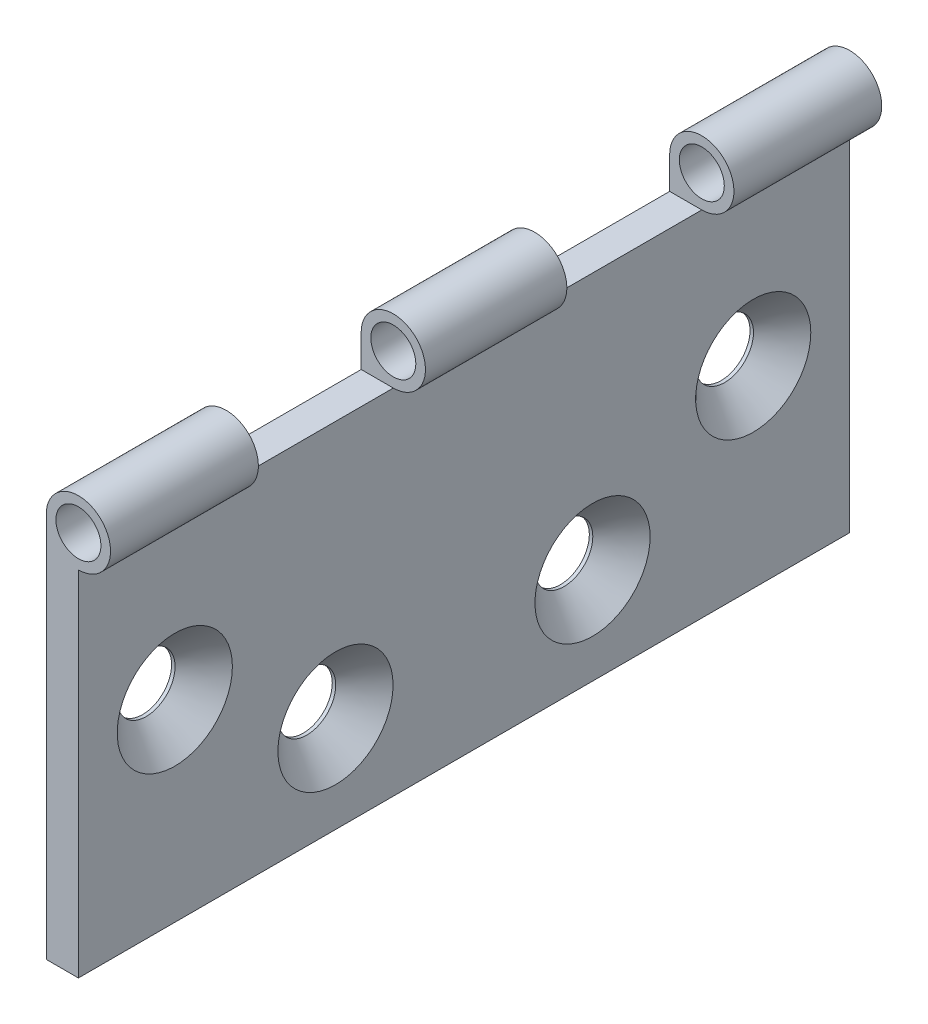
SolidWorks part; units mm, degrees
ref_plane "Alzado" through (0, 0, 0) normal (0, 0, 1) x (1, 0, 0)
ref_plane "Planta" through (0, 0, 0) normal (0, 1, 0) x (1, 0, 0)
ref_plane "Vista lateral" through (0, 0, 0) normal (1, 0, 0) x (0, 0, -1)
sketch "Croquis1" plane through (0, 0, 0) normal (0, 0, 1) x (1, 0, 0)
  line L0 (0, 0) -> (0, 60)
extrude "Extruir-Lámina1" add sketch "Croquis1" along normal mid plane 120 thin
sketch "Croquis2" plane through (0, 0, 60) normal (0, 0, 1) x (1, 0, 0)
  circle A0 centre (5, 60) radius 5
sweep "Barrer1" add profiles "Croquis2"
sketch "Croquis3" plane through (0, 0, 60) normal (0, 0, 1) x (1, 0, 0)
  circle A0 centre (5, 60) radius 3.5
  dimension "D1" = 7
extrude "Cortar-Extruir1" cut sketch "Croquis3" against normal through all
hole_wizard "Refrentado para tornillo tapón con cabeza plana de clavija de M82" positions "Croquis7" profile "Croquis6" countersink size "M8" standard "Ansi Metric"
sketch "Croquis7" plane through (5, 0, 0) normal (1, 0, 0) x (0, 0, -1)
  line L0 (-60, 0) -> (60, 0) construction
  line L1 (-60, 0) -> (-60, 55) construction
  point P0 (-45, 30)
  point P2 (-20, 15)
sketch "Croquis6" plane through (5, 30, 45) normal (0, 1, 0) x (0, 0, -1)
  line L0 (0, 0) -> (0, 5)
  line L1 (0, 5) -> (4.5, 5)
  line L2 (4.5, 5) -> (4.5, 4.46)
  line L3 (4.5, 4.46) -> (8.96, 0)
  line L5 (8.96, 0) -> (0, 0)
  line L6 (-4.5, 4.46) -> (-8.96, 0) construction
  line L11 (0, -6.35) -> (0, 107.95) construction
  dimension "Diámetro de taladro hasta el siguiente" = 9
  dimension "Profundidad de taladro hasta el siguiente" = 5
  dimension "Diámetro de avellanado cercano" = 17.92
  dimension "Ángulo de avellanado cercano" = 90
mirror "Simetría1" about plane through (0, 0, 0) normal (0, 0, 1) of "Refrentado para tornillo tapón con cabeza plana de clavija de M82"
sketch "diseño de cortes" plane through (5, 0, 0) normal (1, 0, 0) x (0, 0, -1)
  line L1 (-60, 65) -> (-60, 55) construction
  line L2 (60, 54) -> (-60, 54)
  line L3 (60, 54) -> (-60, 54)
  line L4 (60, 55) -> (60, 65) construction
  line L5 (-60, 65) -> (-60, 54)
  line L6 (60, 54) -> (60, 65)
  line L7 (-60, 65) -> (60, 65)
  line L8 (-36, 65) -> (-36, 54)
  line L9 (-12, 65) -> (-12, 54)
  line L11 (0, 65) -> (0, 0) construction
  line L12 (12, 65) -> (12, 54)
  line L13 (36, 65) -> (36, 54)
sketch "Croquis11" plane through (5, 0, 0) normal (1, 0, 0) x (0, 0, -1)
  line L0 (60, 54) -> (-60, 54) construction
  line L1 (-60, 65) -> (-60, 54) construction
  line L2 (-60, 65) -> (60, 65) construction
  line L3 (60, 54) -> (60, 65) construction
  line L4 (60, 0) -> (60, 55)
  line L5 (60, 55) -> (-60, 55)
  line L6 (-60, 55) -> (-60, 0)
  line L7 (-60, 0) -> (60, 0)
  line L8 (60, 0) -> (60, 55)
  line L9 (60, 55) -> (-60, 55)
  line L10 (-60, 55) -> (-60, 0)
  line L11 (-60, 0) -> (60, 0)
  line L12 (37, 54) -> (11, 54)
  line L13 (-60, 55) -> (-60, 54)
  line L14 (-37, 65) -> (-11, 65)
  line L15 (60, 54) -> (60, 55)
  line L18 (-37, 65) -> (-37, 54)
  line L19 (-37, 65) -> (-37, 54)
  line L21 (37, 65) -> (37, 54)
  line L22 (37, 65) -> (37, 54)
  line L24 (-11, 65) -> (-11, 54)
  line L25 (-11, 65) -> (-11, 54)
  line L26 (11, 65) -> (37, 65)
  line L27 (11, 65) -> (11, 54)
  line L28 (11, 65) -> (11, 54)
  line L29 (-11, 54) -> (-37, 54)
  dimension "D1" = 0
  dimension "D2" = 1
  dimension "D3" = 1
  dimension "D4" = 1
  dimension "D5" = 1
extrude "2Cortes" cut sketch "Croquis11" against normal through all and the other way through all contours L25 L14 L19 M14 | L26 L28 L9 L22
sketch "Croquis10" plane through (5, 0, 0) normal (1, 0, 0) x (0, 0, -1)
  line L0 (60, 54) -> (-60, 54) construction
  line L1 (-60, 65) -> (-60, 54) construction
  line L2 (-60, 65) -> (60, 65) construction
  line L3 (60, 54) -> (60, 65) construction
  line L4 (60, 0) -> (60, 55)
  line L5 (60, 55) -> (37, 55)
  line L6 (-60, 55) -> (-60, 0)
  line L7 (-60, 0) -> (60, 0)
  line L8 (60, 0) -> (60, 55)
  line L9 (60, 55) -> (37, 55)
  line L10 (-60, 55) -> (-60, 0)
  line L11 (-60, 0) -> (60, 0)
  line L12 (60, 54) -> (35, 54)
  line L13 (-60, 65) -> (-60, 54)
  line L14 (-60, 65) -> (-35, 65)
  line L15 (60, 54) -> (60, 65)
  line L18 (-35, 65) -> (-35, 54)
  line L19 (-35, 65) -> (-35, 54)
  line L21 (35, 65) -> (35, 54)
  line L22 (35, 65) -> (35, 54)
  line L24 (-13, 65) -> (-13, 54)
  line L25 (-13, 65) -> (-13, 54)
  line L26 (-13, 65) -> (13, 65)
  line L27 (13, 65) -> (13, 54)
  line L28 (13, 65) -> (13, 54)
  line L29 (-35, 54) -> (-60, 54)
  line L30 (35, 65) -> (60, 65)
  line L31 (13, 54) -> (-13, 54)
  line L36 (37, 55) -> (11, 55)
  line L37 (37, 55) -> (11, 55)
  line L38 (11, 55) -> (-11, 55)
  line L39 (11, 55) -> (-11, 55)
  line L40 (-11, 55) -> (-37, 55)
  line L41 (-11, 55) -> (-37, 55)
  line L42 (-37, 55) -> (-60, 55)
  line L43 (-37, 55) -> (-60, 55)
  dimension "D1" = 0
  dimension "D2" = 1
  dimension "D3" = 1
  dimension "D4" = 1
  dimension "D5" = 1
extrude "3Cortes" [suppressed] cut sketch "Croquis10" against normal through all and the other way through all contours L19 L14 L13 L9 | L28 L26 L25 M14 | L30 L22 L15 M14
equation "\"D1@Croquis7\"= \"D1@Croquis1\" / 2"
equation "\"D4@Croquis7\"= \"D1@Extruir-Lámina1\" / 3"
equation "\"D2@diseño de cortes\" = \"D1@Extruir-Lámina1\" / 5"
equation "\"D3@diseño de cortes\"= \"D1@Extruir-Lámina1\" / 5"
